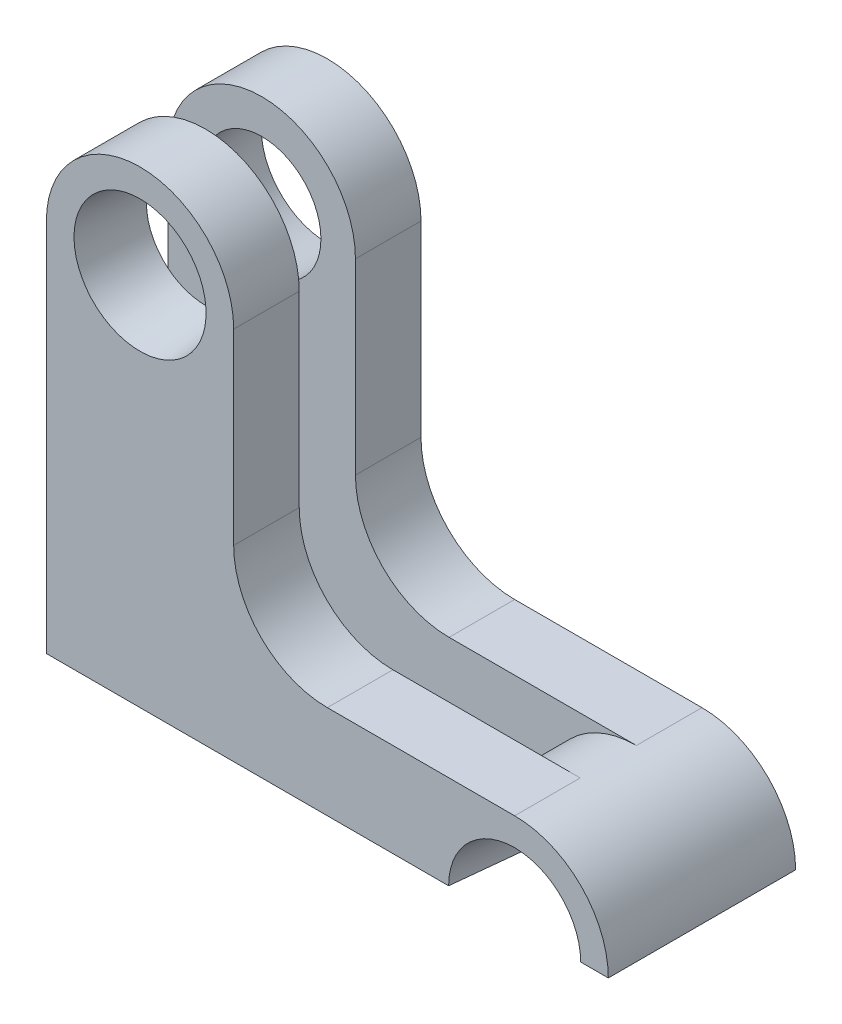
SolidWorks part; units mm, degrees
ref_plane "Front Plane" through (0, 0, 0) normal (0, 0, 1) x (1, 0, 0)
ref_plane "Top Plane" through (0, 0, 0) normal (0, 1, 0) x (1, 0, 0)
ref_plane "Right Plane" through (0, 0, 0) normal (1, 0, 0) x (0, 0, -1)
sketch "Sketch1" plane through (0, 0, 0) normal (0, 0, -1) x (-1, 0, 0)
  line L0 (0, 0) -> (40, 0)
  line L1 (50, 10) -> (50, 50)
  line L2 (30, 50) -> (30, 30)
  line L3 (20, 20) -> (0, 20)
  arc A0 (50, 50) -> (30, 50) centre (40, 50) ccw
  arc A1 (0, 20) -> (0, 0) centre (0, 10) ccw
  arc A2 (30, 30) -> (20, 20) centre (20, 30) cw
  arc A3 (40, 0) -> (50, 10) centre (40, 10) ccw
  point P13 (50, 0)
  dimension "D1" = 10
  dimension "D2" = 10
  dimension "D3" = 50
  dimension "D4" = 50
extrude "Extrude1" add sketch "Sketch1" against normal mid plane 20
sketch "Sketch2" plane through (0, 0, 0) normal (0, 1, 0) x (1, 0, 0)
  line L0 (10, 0) -> (-50, 0) construction
  line L1 (10, -10) -> (10, 10) construction
  line L2 (-50, -10) -> (-50, 10) construction
  line L3 (10, 3) -> (-50, 3)
  line L4 (10, -3) -> (-50, -3)
  line L5 (10, 3) -> (10, -3)
  line L6 (-50, 3) -> (-50, -3)
  dimension "D1" = 3
  dimension "D2" = 3
extrude "Cut-Extrude1" cut sketch "Sketch2" along normal up to surface (60.001 mm away)
sketch "Sketch3" plane through (0, 0, 0) normal (0, 0, 1) x (1, 0, 0)
  circle A0 centre (-40, 50) radius 6
  circle A1 centre (0, 10) radius 6
  dimension "D1" = 12
extrude "Cut-Extrude2" cut sketch "Sketch3" against normal mid plane 30 draft 6
sketch "Sketch4" plane through (0, 0, 10) normal (0, 0, 1) x (1, 0, 0)
  line L1 (-50, 10) -> (10, 10)
  arc A1 (0, 0) -> (0, 20) centre (0, 10) ccw construction
extrude "Cut-Extrude6" cut sketch "Sketch4" along normal through all and the other way through all flip side to cut
